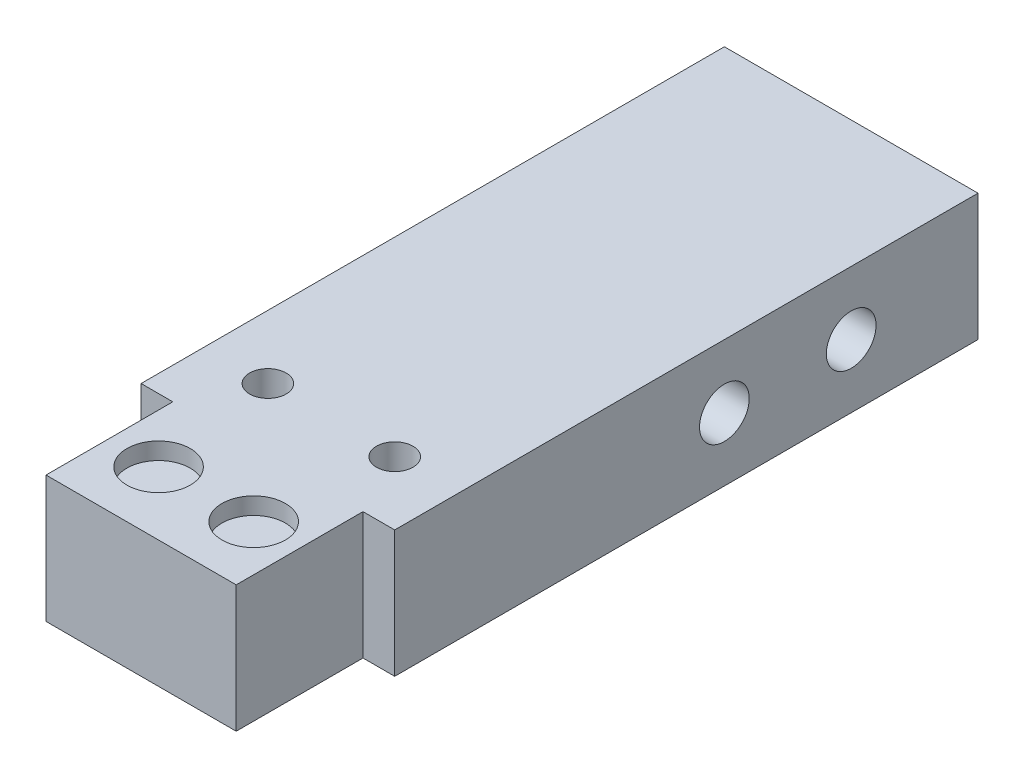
SolidWorks part; units mm, degrees
ref_plane "Front" through (0, 0, 0) normal (0, 0, 1) x (1, 0, 0)
ref_plane "Top" through (0, 0, 0) normal (0, 1, 0) x (1, 0, 0)
ref_plane "Right" through (0, 0, 0) normal (1, 0, 0) x (0, 0, -1)
sketch "Sketch1" plane through (0, 0, 0) normal (1, 0, 0) x (0, 0, -1)
  line L0 (-50.8, 22.86) -> (-50.8, 6.35)
  line L1 (-63.5, -6.35) -> (7.62, -6.35)
  line L2 (-50.8, 6.35) -> (-63.5, 6.35)
  line L3 (7.62, -6.35) -> (7.62, 6.35)
  line L4 (7.62, 6.35) -> (-38.1, 6.35)
  line L5 (-63.5, 6.35) -> (-63.5, -6.35)
  line L7 (-50.8, 22.86) -> (-38.1, 6.35)
  point P0 (0, 0)
  dimension "D3" = 16.51
  dimension "D4" = 12.7
extrude "Boss-Extrude1" add sketch "Sketch1" along normal mid plane 25.4
sketch "Sketch5" plane through (0, 6.35, 0) normal (0, 1, 0) x (1, 0, 0)
  line L2 (12.7, -63.5) -> (-12.7, -63.5) construction
  line L3 (-12.7, -50.8) -> (-9.525, -50.8)
  line L4 (-12.7, -50.8) -> (-12.7, -63.5)
  line L5 (-12.7, -63.5) -> (-9.525, -63.5)
  line L6 (-9.525, -50.8) -> (-9.525, -63.5)
  line L9 (12.7, -50.8) -> (9.525, -50.8)
  line L10 (12.7, -50.8) -> (12.7, -63.5)
  line L11 (12.7, -63.5) -> (9.525, -63.5)
  line L12 (9.525, -50.8) -> (9.525, -63.5)
extrude "Cut-Extrude4" cut sketch "Sketch5" against normal blind 12.7
sketch "Sketch7" plane through (0, 6.35, 0) normal (0, 1, 0) x (1, 0, 0)
  line L0 (-9.525, -63.5) -> (0.326, -50.8) construction
  line L1 (9.525, -50.8) -> (-9.525, -50.8) construction
  line L2 (0.326, -50.8) -> (9.525, -63.5) construction
  circle A0 centre (-4.5995, -57.15) radius 3.175
  circle A1 centre (4.9255, -57.15) radius 3.175
extrude "Cut-Extrude5" cut sketch "Sketch7" against normal blind 1.7018
sketch "Sketch8" plane through (0, 6.35, 0) normal (0, 1, 0) x (1, 0, 0)
  line L1 (-12.7, -38.1) -> (12.7, -38.1)
  line L2 (-12.7, -38.1) -> (-12.7, -50.8)
  line L3 (-12.7, -50.8) -> (12.7, -50.8)
  line L4 (12.7, -38.1) -> (12.7, -50.8)
extrude "Cut-Extrude6" cut sketch "Sketch8" along normal blind 17.78
sketch "Sketch9" plane through (0, 6.35, 0) normal (0, 1, 0) x (1, 0, 0)
  line L0 (-12.7, -50.8) -> (-12.7, -44.45) construction
  line L1 (-12.7, 7.62) -> (-12.7, -50.8) construction
  line L2 (-12.7, -44.45) -> (-6.35, -44.45) construction
  line L3 (-6.35, -44.45) -> (6.35, -44.45) construction
  circle A0 centre (-6.35, -44.45) radius 1.8288
  circle A1 centre (6.35, -44.45) radius 1.8288
extrude "Cut-Extrude7" cut sketch "Sketch9" against normal blind 17.78
sketch "Sketch10" plane through (12.7, 0, 0) normal (1, 0, 0) x (0, 0, -1)
  line L0 (7.62, 0) -> (-5.08, 0) construction
  line L1 (7.62, -6.35) -> (7.62, 6.35) construction
  line L2 (-17.78, 0) -> (7.62, 0) construction
  circle A0 centre (-17.78, 0) radius 2.4892
  circle A1 centre (-5.08, 0) radius 2.4892
extrude "Cut-Extrude8" cut sketch "Sketch10" against normal blind 25.4
